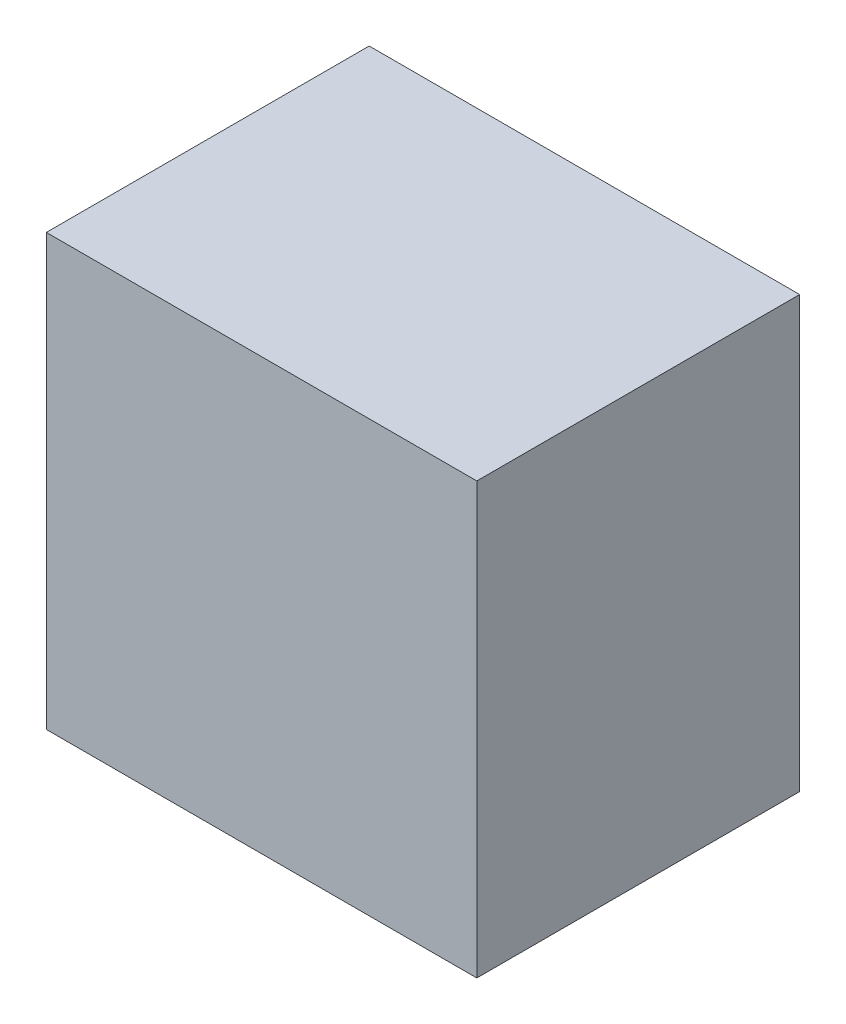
SolidWorks part; units mm, degrees
ref_plane "Front" through (0, 0, 0) normal (0, 0, 1) x (1, 0, 0)
ref_plane "Top" through (0, 0, 0) normal (0, 1, 0) x (1, 0, 0)
ref_plane "Right" through (0, 0, 0) normal (1, 0, 0) x (0, 0, -1)
sketch "Sketch1" plane through (0, 0, 0) normal (0, 0, 1) x (1, 0, 0)
  line L0 (-50, 100) -> (-50, 0)
  line L1 (-50, 0) -> (50, 0)
  line L2 (50, 0) -> (50, 100)
  line L3 (-50, 100) -> (0, 100)
  line L7 (0, 100) -> (50, 100)
  dimension "D1" = 100
  dimension "D2" = 100
extrude "Extrude1" add sketch "Sketch1" along normal mid plane 75
